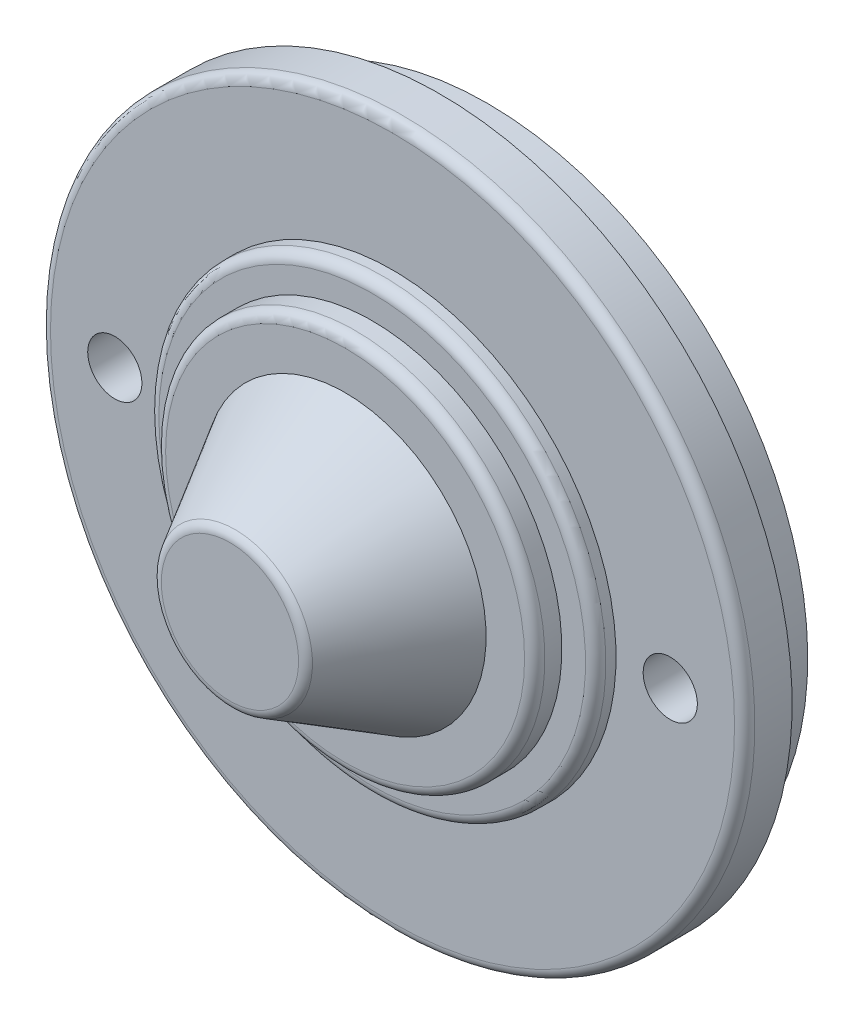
SolidWorks part; units mm, degrees
ref_plane "Plan1" through (0, 0, 0) normal (0, 0, 1) x (1, 0, 0)
ref_plane "Plan2" through (0, 0, 0) normal (0, 1, 0) x (1, 0, 0)
ref_plane "Plan3" through (0, 0, 0) normal (1, 0, 0) x (0, 0, -1)
sketch "Esquisse2" plane through (0, 0, 0) normal (-1, 0, 0) x (0, 0, 1)
  line L0 (-29.0601, 23.6384) -> (21.6209, 23.6384) construction
  line L1 (-81.1363, 23.6384) -> (-85.1363, 23.6384) construction
  line L2 (-8.1363, 47.2884) -> (-4.6363, 47.2884)
  line L4 (-4.6363, 47.2884) -> (-4.6363, 49.6365)
  line L5 (-4.6363, 49.6365) -> (-1.8863, 49.6365)
  line L6 (-1.1363, 48.8865) -> (-1.1363, 40.1384)
  line L7 (-1.1363, 40.1384) -> (-0.3863, 40.1384)
  line L8 (0.3637, 37.6384) -> (1.6137, 37.6384)
  line L9 (2.3637, 34.0458) -> (10.4887, 29.3549)
  line L10 (10.8637, 28.7054) -> (10.8637, 23.6384)
  line L11 (-8.1363, 47.2884) -> (-8.1363, 45.5884)
  line L12 (-8.1363, 45.5884) -> (-4.6363, 45.5884)
  line L13 (-5.1363, 47.2884) -> (-85.1363, 47.2884) construction
  line L14 (-4.6363, 45.5884) -> (-4.6363, 39.6384)
  line L15 (-4.6363, 39.6384) -> (-6.0863, 39.6384)
  line L16 (-6.8363, 38.8884) -> (-6.8363, 37.1384)
  line L17 (-6.8363, 37.1384) -> (-3.4363, 37.1384)
  line L18 (-3.4363, 37.1384) -> (-3.4363, 29.6384)
  line L19 (-9.1363, 31.5821) -> (-9.1363, 29.68) construction
  line L20 (0.3637, 39.3884) -> (0.3637, 37.6384)
  line L21 (2.3637, 36.8884) -> (2.3637, 34.0458)
  line L22 (-5.1363, 49.6365) -> (-85.1363, 49.6365) construction
  line L23 (-3.4363, 29.6384) -> (5.5637, 29.6384)
  line L24 (5.5637, 29.6384) -> (8.5637, 27.9063)
  line L25 (8.5637, 27.9063) -> (8.5637, 23.6384)
  line L26 (8.5637, 23.6384) -> (10.8637, 23.6384)
  line L27 (-4.6363, -2.3616) -> (-4.6363, 49.6384) construction
  arc A0 (10.4887, 29.3549) -> (10.8637, 28.7054) centre (10.1137, 28.7054) cw
  arc A1 (1.6137, 37.6384) -> (2.3637, 36.8884) centre (1.6137, 36.8884) cw
  arc A2 (-0.3863, 40.1384) -> (0.3637, 39.3884) centre (-0.3863, 39.3884) cw
  arc A3 (-1.8863, 49.6365) -> (-1.1363, 48.8865) centre (-1.8863, 48.8865) cw
  arc A4 (-6.8363, 38.8884) -> (-6.0863, 39.6384) centre (-6.0863, 38.8884) cw
  point P36 (10.8637, 29.1384)
  point P39 (2.3637, 37.6384)
  point P42 (0.3637, 40.1384)
  point P45 (-1.1363, 49.6365)
  point P48 (-6.8363, 39.6384)
  dimension "D18" = 0.75
  dimension "D1" = 3.5
  dimension "D2" = 16
  dimension "D3" = 14
  dimension "D4" = 16.5
  dimension "D5" = 5.5
  dimension "D6" = 1.7
  dimension "D7" = 3.5
  dimension "D8" = 13.5
  dimension "D9" = 2.2
  dimension "D10" = 1.5
  dimension "D11" = 3.4
  dimension "D12" = 8.5
  dimension "D13" = 30
  dimension "D14" = 2
  dimension "D15" = 6
  dimension "D16" = 12
  dimension "D17" = 9
revolve "Base-Révolution" add sketch "Esquisse2" angle 360 about L0
sketch "Esquisse3" plane through (0, 0, -4.6363) normal (0, 0, -1) x (-1, 0, 0)
  circle A0 centre (20.5, 23.6384) radius 3
  circle A1 centre (-20.5, 23.6384) radius 3
  dimension "D1" = 6
extrude "Boss.-Extru.1" add sketch "Esquisse3" along normal blind 3.5
sketch "Esquisse4" plane through (0, 0, -8.1363) normal (0, 0, -1) x (-1, 0, 0)
  circle A0 centre (20.5, 23.6384) radius 2
  circle A1 centre (-20.5, 23.6384) radius 2
  dimension "D1" = 4
extrude "Enlèv. mat.-Extru.1" cut sketch "Esquisse4" against normal through all
sketch "Esquisse5" plane through (0, 0, -8.1363) normal (0, 0, -1) x (-1, 0, 0)
  line L0 (20.5, 23.6384) -> (29.0867, 23.6384) construction
  line L1 (21.8706, 32.6384) -> (20.0201, 32.6384)
  line L2 (23.3093, 27.6384) -> (21.6697, 27.1353)
  circle A1 centre (0, 23.6384) radius 23.65 construction
  arc A2 (21.7818, 26.3508) -> (-21.7818, 26.3508) centre (0, 23.6384) ccw construction
  arc A3 (23.3093, 27.6384) -> (21.8706, 32.6384) centre (0, 23.6384) ccw
  arc A5 (21.6697, 27.1353) -> (20.0201, 32.6384) centre (0, 23.6384) ccw
  arc A7 (21.7818, 26.3508) -> (21.7818, 20.926) centre (20.5, 23.6384) ccw construction
  dimension "D1" = 9
  dimension "D2" = 4
extrude "Enlèv. mat.-Extru.2" cut sketch "Esquisse5" against normal blind 3.5
